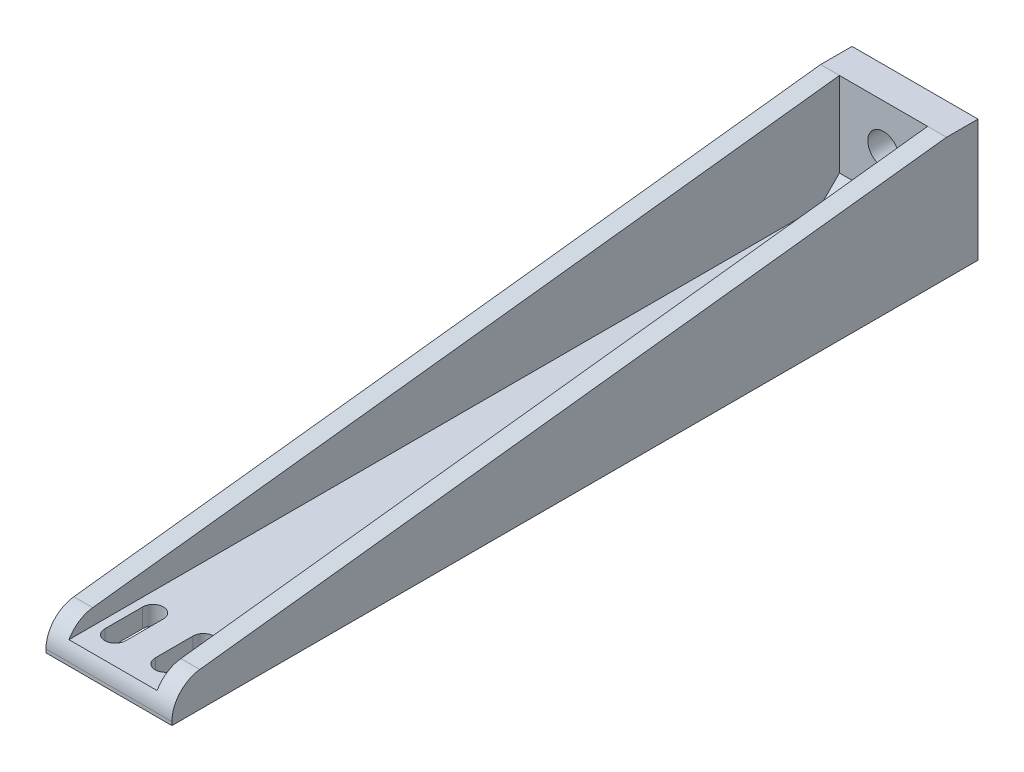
SolidWorks part; units mm, degrees
ref_plane "Спереди" through (0, 0, 0) normal (0, 0, 1) x (1, 0, 0)
ref_plane "Сверху" through (0, 0, 0) normal (0, 1, 0) x (1, 0, 0)
ref_plane "Справа" through (0, 0, 0) normal (1, 0, 0) x (0, 0, -1)
other "Configuration Table"
sketch "Эскиз1" plane through (0, 0, 0) normal (1, 0, 0) x (0, 0, -1)
  line L0 (-128, 0) -> (-128, 5)
  line L1 (0, 0) -> (-128, 0)
  line L2 (0, 0) -> (0, 20)
  line L3 (0, 20) -> (-128, 20) construction
  line L4 (-128, 0) -> (-128, 20) construction
  line L5 (-128, 5) -> (0, 20)
  dimension "D1" = 128
  dimension "D2" = 20
  dimension "D3" = 5
extrude "Бобышка-Вытянуть1" add sketch "Эскиз1" along normal blind 20
sketch "Эскиз2" plane through (0, 0, 128) normal (0, 0, 1) x (1, 0, 0)
  line L0 (20, 5) -> (0, 5) construction
  line L1 (3, 5) -> (17, 5) construction
  line L2 (3, 5) -> (3, 3)
  line L3 (3, 3) -> (17, 3)
  line L4 (17, 5) -> (17, 3)
  line L5 (0, 5) -> (0, 0) construction
  line L6 (20, 0) -> (0, 0) construction
  line L7 (20, 5) -> (20, 0) construction
  line L8 (20, 20) -> (0, 20) construction
  line L9 (17, 5) -> (3, 5) construction
  line L10 (17, 5) -> (17, 20)
  line L11 (17, 20) -> (3, 20)
  line L12 (3, 5) -> (3, 20)
  point P16 (3, 20)
  dimension "D1" = 3
  dimension "D2" = 3
  dimension "D3" = 3
extrude "Вырез-Вытянуть1" cut sketch "Эскиз2" against normal offset from surface (123 mm away) 5
fillet "Скругление1" radius 5 1 edges at (1.5, 5, 128)
sketch "Эскиз3" plane through (0, 3, 0) normal (0, 1, 0) x (1, 0, 0)
  line L0 (6, -123) -> (6, -117) construction
  line L1 (4.35, -123) -> (4.35, -117)
  line L2 (7.65, -123) -> (7.65, -117)
  line L3 (14, -123) -> (14, -117) construction
  line L4 (12.35, -123) -> (12.35, -117)
  line L5 (15.65, -123) -> (15.65, -117)
  line L6 (10, -127.3596) -> (10, -116.5232) construction
  line L8 (3, -127.3596) -> (17, -127.3596) construction
  line L9 (14, -123) -> (6, -123) construction
  line L11 (20, -128) -> (0, -128) construction
  arc A0 (4.35, -123) -> (7.65, -123) centre (6, -123) ccw
  arc A1 (7.65, -117) -> (4.35, -117) centre (6, -117) ccw
  arc A2 (12.35, -123) -> (15.65, -123) centre (14, -123) ccw
  arc A3 (15.65, -117) -> (12.35, -117) centre (14, -117) ccw
  point P2 (6, -120)
  point P7 (14, -120)
  point P17 (10, -127.3596)
  point P21 (10, -123)
  dimension "D1" = 3.3
  dimension "D2" = 8
  dimension "D3" = 6
  dimension "D4" = 8
extrude "Вырез-Вытянуть2" cut sketch "Эскиз3" against normal through all
chamfer "Фаска1" distance 3 angle 45 1 edges at (10, 3, 5)
sketch "Эскиз5" plane through (0, 0, 1.1599) normal (0, 1, 0) x (1, 0, 0)
  line L0 (20, 1.1599) -> (0, 1.1599) construction
  line L1 (7, 4.1599) -> (13, 4.1599)
  line L2 (7, 4.1599) -> (7, -1.8401)
  line L3 (7, -1.8401) -> (13, -1.8401)
  line L4 (13, 4.1599) -> (13, -1.8401)
  line L5 (7, 4.1599) -> (13, -1.8401) construction
  line L6 (7, -1.8401) -> (13, 4.1599) construction
  point P0 (10, 1.1599)
  dimension "D1" = 6
  dimension "D2" = 3
extrude "Бобышка-Вытянуть3" add sketch "Эскиз5" along normal up to surface (20.3516 mm away)
sketch "Эскиз6" plane through (0, 0, 5) normal (0, 0, 1) x (1, 0, 0)
  line L0 (3, 19.4141) -> (17, 6) construction
  circle A0 centre (10, 12.707) radius 2.5
  dimension "D1" = 5
extrude "Вырез-Вытянуть3" cut sketch "Эскиз6" against normal through all
sketch "Эскиз7" plane through (0, 0, -3) normal (0, 0, -1) x (-1, 0, 0)
  circle A0 centre (-10, 12.707) radius 6
  dimension "D1" = 12
extrude "Вырез-Вытянуть4" cut sketch "Эскиз7" against normal up to surface (3 mm away)
sketch "Эскиз8" plane through (0, 0, -3) normal (0, 0, -1) x (-1, 0, 0)
  line L3 (-13, 20.3516) -> (-13, 17.9032)
  line L4 (-7, 17.9032) -> (-7, 20.3516)
  line L5 (-7, 20.3516) -> (-13, 20.3516)
  line L6 (-13, 20.3516) -> (-13, 17.9032)
  line L7 (-7, 17.9032) -> (-7, 20.3516)
  line L8 (-7, 20.3516) -> (-13, 20.3516)
  arc A1 (-7, 17.9032) -> (-13, 17.9032) centre (-10, 12.707) ccw
  arc A2 (-7, 17.9032) -> (-13, 17.9032) centre (-10, 12.707) ccw
  dimension "D1" = 0
extrude "Вырез-Вытянуть5" cut sketch "Эскиз8" against normal up to surface (3 mm away)
sketch "Эскиз9" plane through (20, 0, 0) normal (1, 0, 0) x (0, 0, -1)
  line L0 (0, 19.4141) -> (-5, 19.4141)
  line L1 (0, 0) -> (0, 20) construction
  line L2 (-5, 19.4141) -> (0, 20)
  line L3 (0, 20) -> (0, 19.4141)
extrude "Вырез-Вытянуть6" cut sketch "Эскиз9" against normal through all
chamfer "Фаска2" distance 1 angle 45 2 edges at (7, 3.7554, -3) (13, 3.7554, -3)
